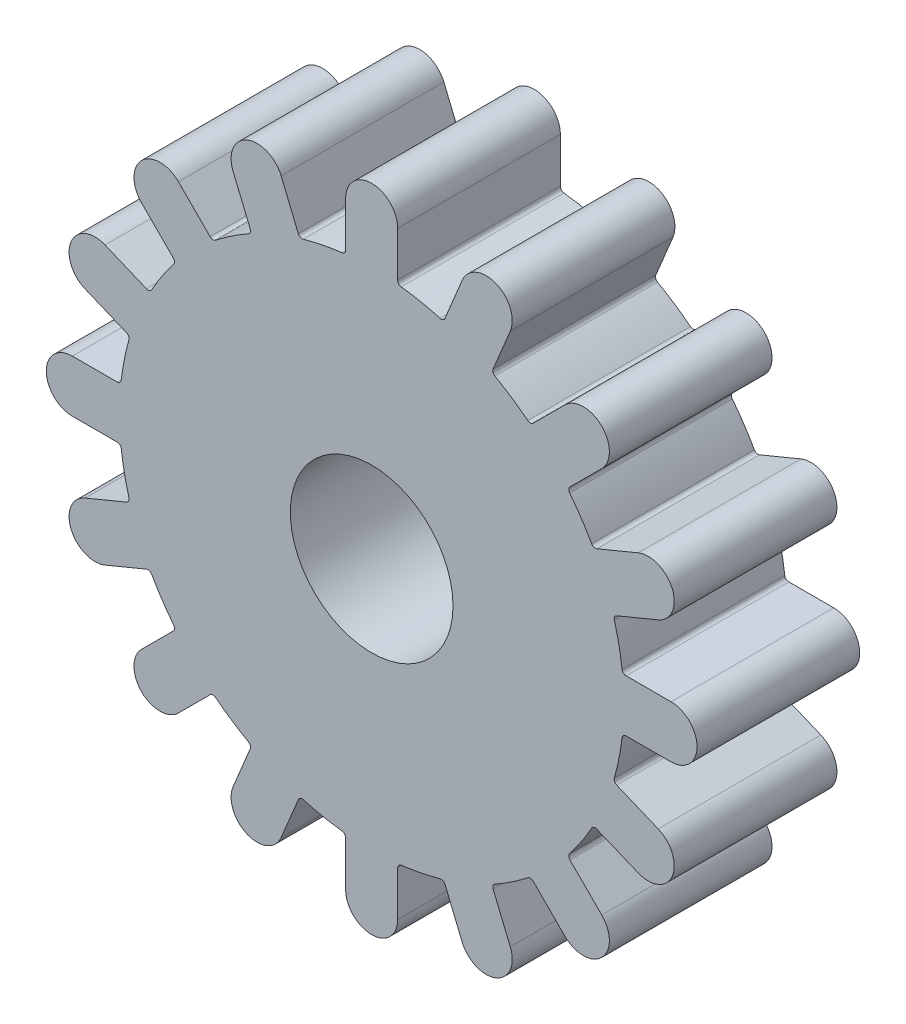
SolidWorks part; units mm, degrees
ref_plane "Front Plane" through (0, 0, 0) normal (0, 0, 1) x (1, 0, 0)
ref_plane "Top Plane" through (0, 0, 0) normal (0, 1, 0) x (1, 0, 0)
ref_plane "Right Plane" through (0, 0, 0) normal (1, 0, 0) x (0, 0, -1)
sketch "Sketch1" plane through (0, 0, 0) normal (0, 0, 1) x (1, 0, 0)
  line L0 (-1.6, 18.4) -> (-1.6, 15.641)
  line L1 (1.6, 18.4) -> (1.6, 15.641)
  line L2 (5.5632, 17.6117) -> (4.5073, 15.0627)
  line L3 (8.5196, 16.3871) -> (7.4637, 13.8381)
  line L4 (11.8794, 14.1421) -> (9.9285, 12.1912)
  line L5 (14.1421, 11.8794) -> (12.1912, 9.9285)
  line L6 (16.3871, 8.5196) -> (13.8381, 7.4637)
  line L7 (17.6117, 5.5632) -> (15.0627, 4.5073)
  line L8 (18.4, 1.6) -> (15.641, 1.6)
  line L9 (18.4, -1.6) -> (15.641, -1.6)
  line L10 (17.6117, -5.5632) -> (15.0627, -4.5073)
  line L11 (16.3871, -8.5196) -> (13.8381, -7.4637)
  line L12 (14.1421, -11.8794) -> (12.1912, -9.9285)
  line L13 (11.8794, -14.1421) -> (9.9285, -12.1912)
  line L14 (8.5196, -16.3871) -> (7.4637, -13.8381)
  line L15 (5.5632, -17.6117) -> (4.5073, -15.0627)
  line L16 (1.6, -18.4) -> (1.6, -15.641)
  line L17 (-1.6, -18.4) -> (-1.6, -15.641)
  line L18 (-5.5632, -17.6117) -> (-4.5073, -15.0627)
  line L19 (-8.5196, -16.3871) -> (-7.4637, -13.8381)
  line L20 (-11.8794, -14.1421) -> (-9.9285, -12.1912)
  line L21 (-14.1421, -11.8794) -> (-12.1912, -9.9285)
  line L22 (-16.3871, -8.5196) -> (-13.8381, -7.4637)
  line L23 (-17.6117, -5.5632) -> (-15.0627, -4.5073)
  line L24 (-18.4, -1.6) -> (-15.641, -1.6)
  line L25 (-18.4, 1.6) -> (-15.641, 1.6)
  line L26 (-17.6117, 5.5632) -> (-15.0627, 4.5073)
  line L27 (-16.3871, 8.5196) -> (-13.8381, 7.4637)
  line L28 (-14.1421, 11.8794) -> (-12.1912, 9.9285)
  line L29 (-11.8794, 14.1421) -> (-9.9285, 12.1912)
  line L30 (-8.5196, 16.3871) -> (-7.4637, 13.8381)
  line L31 (-5.5632, 17.6117) -> (-4.5073, 15.0627)
  arc A0 (-1.8206, 15.3927) -> (-4.2085, 14.9177) centre (0, 0) ccw
  arc A1 (4.5073, 15.0627) -> (4.2085, 14.9177) centre (4.2764, 15.1583) cw
  arc A2 (1.6, 18.4) -> (-1.6, 18.4) centre (0, 18.4) ccw
  arc A3 (1.6, 15.641) -> (1.8206, 15.3927) centre (1.85, 15.641) ccw
  arc A4 (-1.6, 15.641) -> (-1.8206, 15.3927) centre (-1.85, 15.641) cw
  arc A5 (8.5196, 16.3871) -> (5.5632, 17.6117) centre (7.0414, 16.9994) ccw
  arc A6 (7.4637, 13.8381) -> (7.5726, 13.5243) centre (7.6947, 13.7424) ccw
  arc A7 (9.9285, 12.1912) -> (9.5969, 12.1717) centre (9.7517, 12.368) cw
  arc A8 (14.1421, 11.8794) -> (11.8794, 14.1421) centre (13.0108, 13.0108) ccw
  arc A9 (12.1912, 9.9285) -> (12.1717, 9.5969) centre (12.368, 9.7517) ccw
  arc A10 (13.8381, 7.4637) -> (13.5243, 7.5726) centre (13.7424, 7.6947) cw
  arc A11 (17.6117, 5.5632) -> (16.3871, 8.5196) centre (16.9994, 7.0414) ccw
  arc A12 (15.0627, 4.5073) -> (14.9177, 4.2085) centre (15.1583, 4.2764) ccw
  arc A13 (15.641, 1.6) -> (15.3927, 1.8206) centre (15.641, 1.85) cw
  arc A14 (18.4, -1.6) -> (18.4, 1.6) centre (18.4, 0) ccw
  arc A15 (15.641, -1.6) -> (15.3927, -1.8206) centre (15.641, -1.85) ccw
  arc A16 (15.0627, -4.5073) -> (14.9177, -4.2085) centre (15.1583, -4.2764) cw
  arc A17 (16.3871, -8.5196) -> (17.6117, -5.5632) centre (16.9994, -7.0414) ccw
  arc A18 (13.8381, -7.4637) -> (13.5243, -7.5726) centre (13.7424, -7.6947) ccw
  arc A19 (12.1912, -9.9285) -> (12.1717, -9.5969) centre (12.368, -9.7517) cw
  arc A20 (11.8794, -14.1421) -> (14.1421, -11.8794) centre (13.0108, -13.0108) ccw
  arc A21 (9.9285, -12.1912) -> (9.5969, -12.1717) centre (9.7517, -12.368) ccw
  arc A22 (7.4637, -13.8381) -> (7.5726, -13.5243) centre (7.6947, -13.7424) cw
  arc A23 (5.5632, -17.6117) -> (8.5196, -16.3871) centre (7.0414, -16.9994) ccw
  arc A24 (4.5073, -15.0627) -> (4.2085, -14.9177) centre (4.2764, -15.1583) ccw
  arc A25 (1.6, -15.641) -> (1.8206, -15.3927) centre (1.85, -15.641) cw
  arc A26 (-1.6, -18.4) -> (1.6, -18.4) centre (0, -18.4) ccw
  arc A27 (-1.6, -15.641) -> (-1.8206, -15.3927) centre (-1.85, -15.641) ccw
  arc A28 (-4.5073, -15.0627) -> (-4.2085, -14.9177) centre (-4.2764, -15.1583) cw
  arc A29 (-8.5196, -16.3871) -> (-5.5632, -17.6117) centre (-7.0414, -16.9994) ccw
  arc A30 (-7.4637, -13.8381) -> (-7.5726, -13.5243) centre (-7.6947, -13.7424) ccw
  arc A31 (-9.9285, -12.1912) -> (-9.5969, -12.1717) centre (-9.7517, -12.368) cw
  arc A32 (-14.1421, -11.8794) -> (-11.8794, -14.1421) centre (-13.0108, -13.0108) ccw
  arc A33 (-12.1912, -9.9285) -> (-12.1717, -9.5969) centre (-12.368, -9.7517) ccw
  arc A34 (-13.8381, -7.4637) -> (-13.5243, -7.5726) centre (-13.7424, -7.6947) cw
  arc A35 (-17.6117, -5.5632) -> (-16.3871, -8.5196) centre (-16.9994, -7.0414) ccw
  arc A36 (-15.0627, -4.5073) -> (-14.9177, -4.2085) centre (-15.1583, -4.2764) ccw
  arc A37 (-15.641, -1.6) -> (-15.3927, -1.8206) centre (-15.641, -1.85) cw
  arc A38 (-18.4, 1.6) -> (-18.4, -1.6) centre (-18.4, 0) ccw
  arc A39 (-15.641, 1.6) -> (-15.3927, 1.8206) centre (-15.641, 1.85) ccw
  arc A40 (-15.0627, 4.5073) -> (-14.9177, 4.2085) centre (-15.1583, 4.2764) cw
  arc A41 (-16.3871, 8.5196) -> (-17.6117, 5.5632) centre (-16.9994, 7.0414) ccw
  arc A42 (-13.8381, 7.4637) -> (-13.5243, 7.5726) centre (-13.7424, 7.6947) ccw
  arc A43 (-12.1912, 9.9285) -> (-12.1717, 9.5969) centre (-12.368, 9.7517) cw
  arc A44 (-11.8794, 14.1421) -> (-14.1421, 11.8794) centre (-13.0108, 13.0108) ccw
  arc A45 (-9.9285, 12.1912) -> (-9.5969, 12.1717) centre (-9.7517, 12.368) ccw
  arc A46 (-7.4637, 13.8381) -> (-7.5726, 13.5243) centre (-7.6947, 13.7424) cw
  arc A47 (-5.5632, 17.6117) -> (-8.5196, 16.3871) centre (-7.0414, 16.9994) ccw
  arc A48 (-4.5073, 15.0627) -> (-4.2085, 14.9177) centre (-4.2764, 15.1583) ccw
  arc A49 (-7.5726, 13.5243) -> (-9.5969, 12.1717) centre (0, 0) ccw
  arc A50 (-12.1717, 9.5969) -> (-13.5243, 7.5726) centre (0, 0) ccw
  arc A51 (4.2085, 14.9177) -> (1.8206, 15.3927) centre (0, 0) ccw
  arc A52 (9.5969, 12.1717) -> (7.5726, 13.5243) centre (0, 0) ccw
  arc A53 (13.5243, 7.5726) -> (12.1717, 9.5969) centre (0, 0) ccw
  arc A54 (15.3927, 1.8206) -> (14.9177, 4.2085) centre (0, 0) ccw
  arc A55 (14.9177, -4.2085) -> (15.3927, -1.8206) centre (0, 0) ccw
  arc A56 (12.1717, -9.5969) -> (13.5243, -7.5726) centre (0, 0) ccw
  arc A57 (7.5726, -13.5243) -> (9.5969, -12.1717) centre (0, 0) ccw
  arc A58 (1.8206, -15.3927) -> (4.2085, -14.9177) centre (0, 0) ccw
  arc A59 (-4.2085, -14.9177) -> (-1.8206, -15.3927) centre (0, 0) ccw
  arc A60 (-9.5969, -12.1717) -> (-7.5726, -13.5243) centre (0, 0) ccw
  arc A61 (-13.5243, -7.5726) -> (-12.1717, -9.5969) centre (0, 0) ccw
  arc A62 (-15.3927, -1.8206) -> (-14.9177, -4.2085) centre (0, 0) ccw
  arc A63 (-14.9177, 4.2085) -> (-15.3927, 1.8206) centre (0, 0) ccw
  circle A64 centre (0, 0) radius 5
  point P149 (0, 0)
  dimension "D1" = 16
  dimension "D2" = 31
  dimension "D3" = 3.2
  dimension "D4" = 0.25
  dimension "D5" = 10
extrude "Boss-Extrude1" add sketch "Sketch1" along normal blind 10
